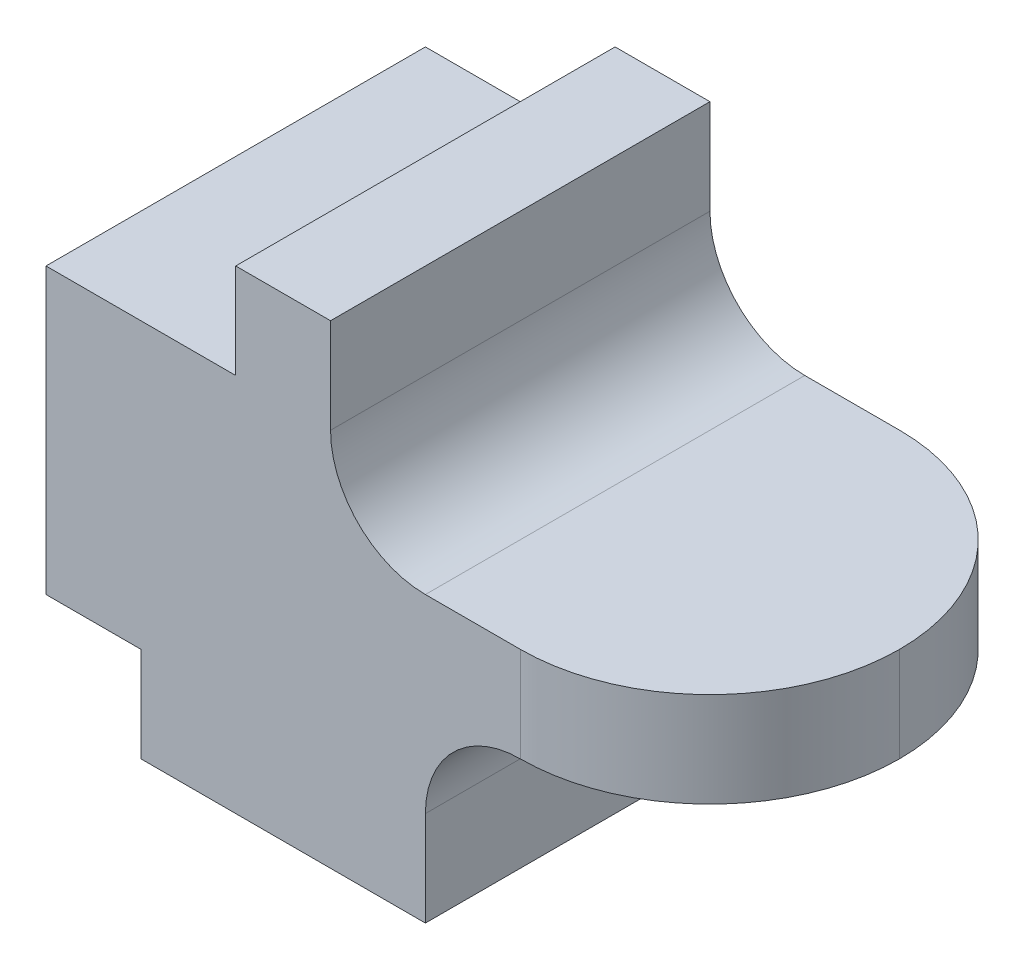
SolidWorks part; units mm, degrees
ref_plane "Front Plane" through (0, 0, 0) normal (0, 0, 1) x (1, 0, 0)
ref_plane "Top Plane" through (0, 0, 0) normal (0, 1, 0) x (1, 0, 0)
ref_plane "Right Plane" through (0, 0, 0) normal (1, 0, 0) x (0, 0, -1)
sketch "Sketch1" plane through (0, 0, 0) normal (0, 0, 1) x (1, 0, 0)
  line L0 (0, 0) -> (0, 10)
  line L1 (0, 10) -> (-10, 10)
  line L2 (-10, 10) -> (-10, 40)
  line L3 (-10, 40) -> (10, 40)
  line L4 (10, 40) -> (10, 50)
  line L5 (10, 50) -> (20, 50)
  line L6 (20, 50) -> (20, 30)
  line L7 (20, 30) -> (60, 30)
  line L8 (60, 30) -> (60, 20)
  line L9 (60, 20) -> (30, 20)
  line L10 (30, 20) -> (30, 0)
  line L11 (30, 0) -> (0, 0)
  dimension "D1" = 30
  dimension "D2" = 10
  dimension "D3" = 10
  dimension "D4" = 30
  dimension "D5" = 20
  dimension "D6" = 30
  dimension "D7" = 10
  dimension "D8" = 40
  dimension "D9" = 20
  dimension "D10" = 20
extrude "Extrude1" add sketch "Sketch1" along normal mid plane 40
fillet "Fillet1" radius 10 2 edges at (30, 20, 0) (20, 30, 0)
fillet "Fillet2" radius 20 2 edges at (60, 25, -20) (60, 25, 20)
